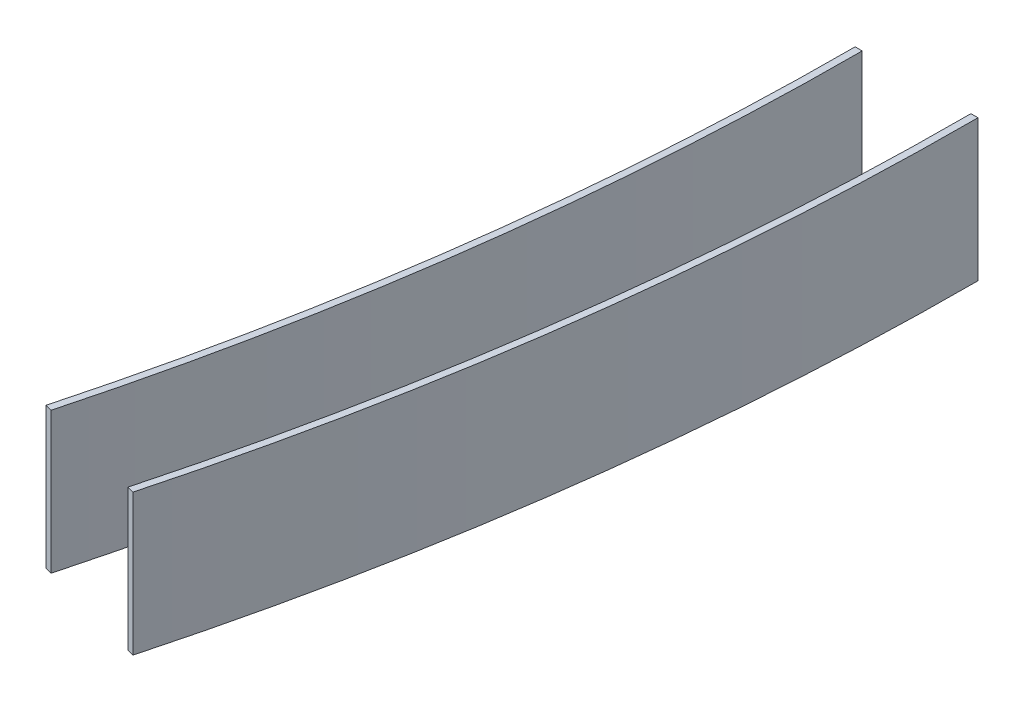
SolidWorks part; units mm, degrees
ref_plane "Спереди" through (0, 0, 0) normal (0, 0, 1) x (1, 0, 0)
ref_plane "Сверху" through (0, 0, 0) normal (0, 1, 0) x (1, 0, 0)
ref_plane "Справа" through (0, 0, 0) normal (1, 0, 0) x (0, 0, -1)
sketch "Эскиз1" plane through (0, 0, 0) normal (0, 0, 1) x (1, 0, 0)
  line L52 (196.15, 0.25) -> (196.15, -9.75)
  line L65 (0, 44.1102) -> (0, 0) construction
  line L75 (200, 12.0049) -> (200, -5.7785) construction
  line L80 (203.85, 0.25) -> (203.85, -9.75)
  line L89 (195.65, 0.25) -> (196.15, 0.25)
  line L91 (195.65, 0.25) -> (195.65, -9.75)
  line L93 (196.15, 0.25) -> (196.15, -9.75)
  line L95 (203.85, -9.75) -> (203.85, 0.25)
  line L97 (204.35, -9.75) -> (204.35, 0.25)
  line L98 (203.85, 0.25) -> (204.35, 0.25)
  line L99 (203.85, -9.75) -> (204.35, -9.75)
  line L100 (195.65, -9.75) -> (196.15, -9.75)
  dimension "D1" = 0.5
  dimension "D2" = 3.85
  dimension "D7" = 10
revolve "Повернуть1" add sketch "Эскиз1" angle 15 about L65
